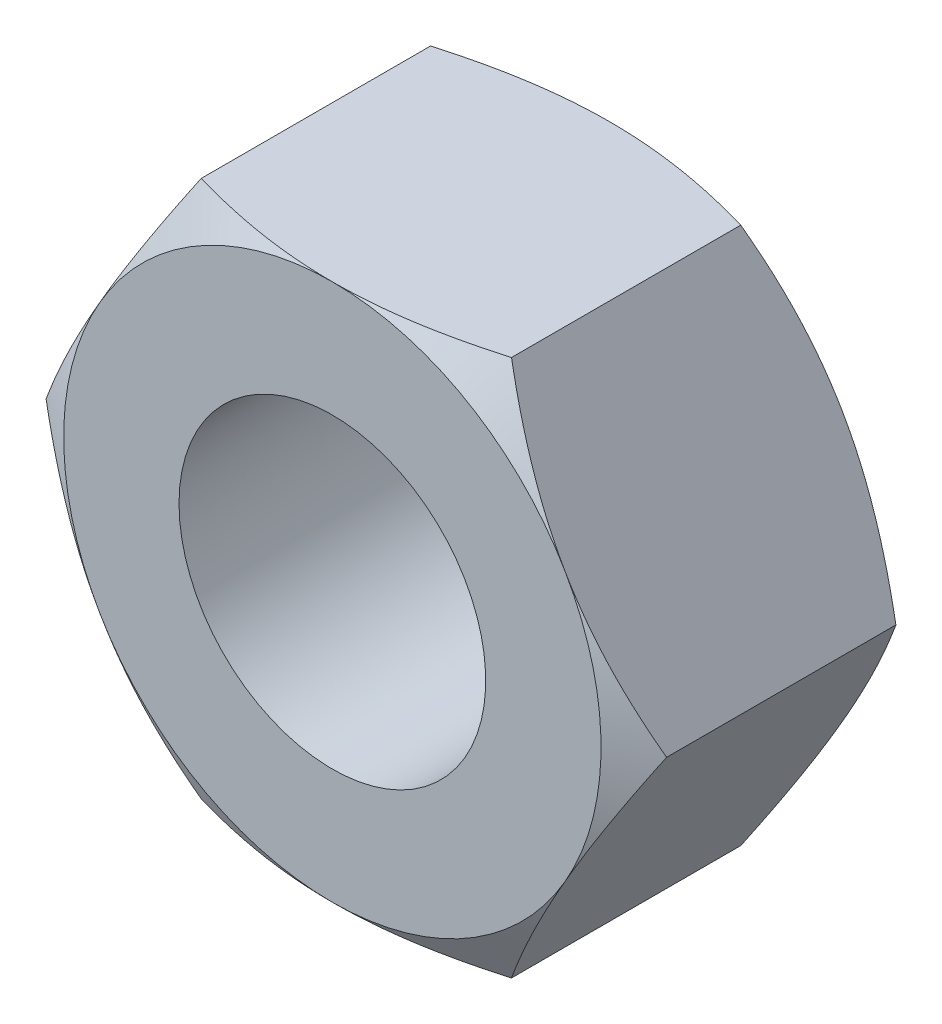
SolidWorks part; units mm, degrees
ref_plane "Front Plane" through (0, 0, 0) normal (0, 0, 1) x (1, 0, 0)
ref_plane "Top Plane" through (0, 0, 0) normal (0, 1, 0) x (1, 0, 0)
ref_plane "Right Plane" through (0, 0, 0) normal (1, 0, 0) x (0, 0, -1)
sketch "Sketch2" plane through (0, 0, 0) normal (0, 0, 1) x (1, 0, 0)
  line L1 (-6.4231, 0) -> (-3.2116, -5.5626)
  line L2 (-3.2116, -5.5626) -> (3.2116, -5.5626)
  line L3 (3.2116, -5.5626) -> (6.4231, 0)
  line L4 (6.4231, 0) -> (3.2116, 5.5626)
  line L5 (3.2116, 5.5626) -> (-3.2116, 5.5626)
  line L6 (-3.2116, 5.5626) -> (-6.4231, 0)
  circle A0 centre (0, 0) radius 5.5626 construction
  dimension "D1" = 11.1252
extrude "Boss-Extrude1" add sketch "Sketch2" along normal blind 5.7404
sketch "Sketch3" plane through (0, 0, 0) normal (0, 0, -1) x (-1, 0, 0)
  line L0 (6.4231, 0) -> (3.2116, -5.5626) construction
  circle A0 centre (0, 0) radius 5.5626
extrude "Cut-Extrude1" cut sketch "Sketch3" against normal blind 5.7404 draft 60 flip side to cut
sketch "Sketch4" plane through (0, 0, 5.7404) normal (0, 0, 1) x (1, 0, 0)
  circle A0 centre (0, 0) radius 5.5626
extrude "Cut-Extrude2" cut sketch "Sketch4" against normal blind 5.7404 draft 60 flip side to cut
sketch "Sketch5" plane through (0, 0, 0) normal (0, 0, -1) x (-1, 0, 0)
  circle A0 centre (0, 0) radius 3.175
  dimension "D1" = 6.35
extrude "Cut-Extrude3" cut sketch "Sketch5" against normal blind 5.7404
